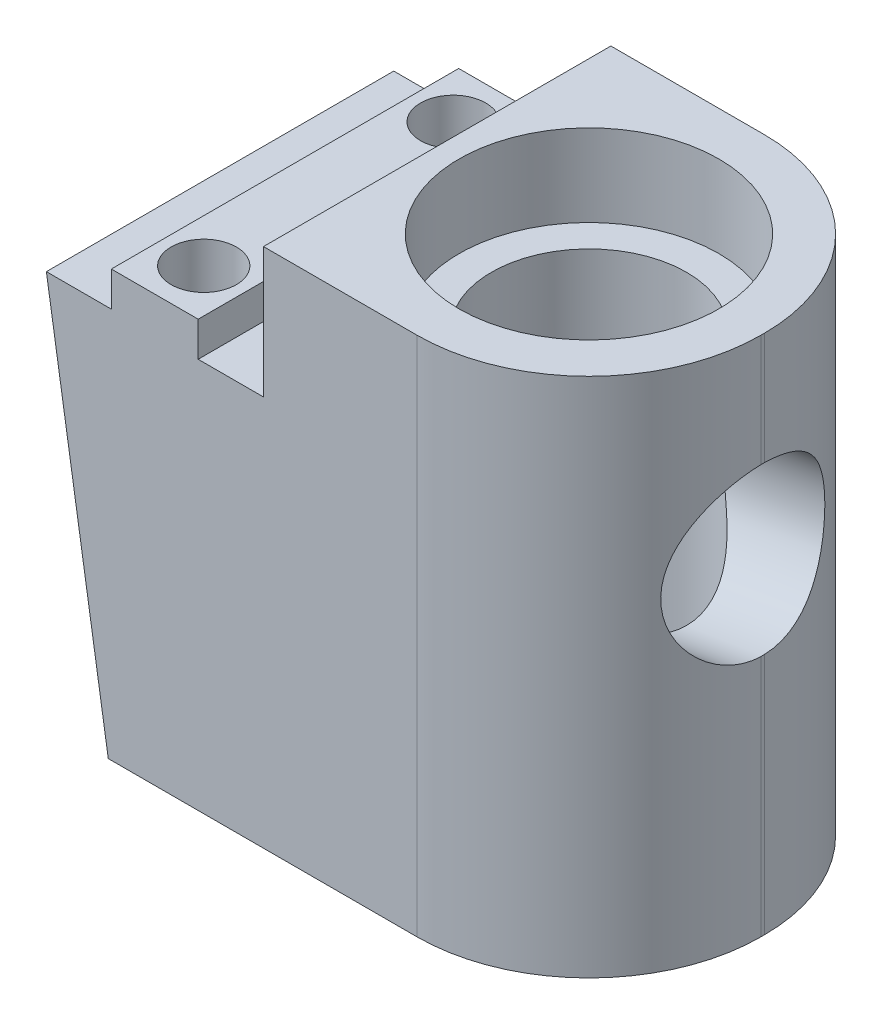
SolidWorks part; units mm, degrees
ref_plane "Front Plane" through (0, 0, 0) normal (0, 0, 1) x (1, 0, 0)
ref_plane "Top Plane" through (0, 0, 0) normal (0, 1, 0) x (1, 0, 0)
ref_plane "Right Plane" through (0, 0, 0) normal (1, 0, 0) x (0, 0, -1)
sketch "Sketch1" plane through (0, 0, 0) normal (0, 0, 1) x (1, 0, 0)
  line L0 (0, 0) -> (-79.9391, 0) construction
  line L1 (-4.7498, 9.525) -> (-9.4996, 9.525)
  line L2 (6.3754, 19.05) -> (30.1752, 19.05)
  line L3 (30.1752, 19.05) -> (30.1752, -19.05)
  line L4 (30.1752, -19.05) -> (0, -19.05)
  line L5 (0, -19.05) -> (0, 0) construction
  line L6 (0, 0) -> (-52.9129, -8.3806) construction
  line L7 (0, 0) -> (30.1752, 4.7793)
  line L9 (-4.9738, -19.05) -> (-9.4996, 9.525)
  line L10 (10.3378, 13.0556) -> (10.3378, -13.0556)
  line L13 (17.4752, 19.05) -> (17.4752, -19.05) construction
  line L14 (7.9756, 19.05) -> (7.9756, 13.0556)
  line L15 (7.9756, 13.0556) -> (26.9748, 13.0556)
  line L16 (26.9748, 13.0556) -> (26.9748, 19.05)
  line L17 (7.9756, -19.05) -> (7.9756, -13.0556)
  line L18 (7.9756, -13.0556) -> (26.9748, -13.0556)
  line L19 (26.9748, -13.0556) -> (26.9748, -19.05)
  line L20 (6.3754, 19.05) -> (6.3754, 9.525)
  line L21 (6.3754, 9.525) -> (1.6002, 9.525)
  line L24 (1.6002, 12.065) -> (-4.7498, 12.065)
  line L25 (-4.7498, 12.065) -> (-4.7498, 9.525)
  line L26 (24.6126, 13.0556) -> (24.6126, -13.0556)
  line L27 (1.6002, 12.065) -> (1.6002, 9.525)
  line L28 (0, -19.05) -> (-4.9738, -19.05)
  point P23 (-7.991, 0)
  dimension "D2" = 30.1752
  dimension "D3" = 19.05
  dimension "D4" = 19.05
  dimension "D5" = 9
  dimension "D7" = 18.9992
  dimension "D8" = 12.7
  dimension "D9" = 5.9944
  dimension "D10" = 23.7998
  dimension "D11" = 3.2004
  dimension "D12" = 9.525
  dimension "D13" = 4.7752
  dimension "D14" = 6.35
  dimension "D15" = 2.54
  dimension "D16" = 15.875
  dimension "D17" = 14.2748
  dimension "D18" = 1.6002
  dimension "D19" = 18.3288
sketch "Sketch2" plane through (0, 0, 0) normal (0, 0, 1) x (1, 0, 0)
  line L0 (0, -19.05) -> (-4.9738, -19.05) construction
  line L1 (30.1752, 19.05) -> (30.1752, -19.05) construction
  line L2 (0, -19.05) -> (-4.9738, -19.05)
  line L5 (-4.9738, -19.05) -> (-9.4996, 9.525) construction
  line L8 (6.3754, 19.05) -> (30.1752, 19.05) construction
  line L9 (30.1752, 19.05) -> (30.1752, -19.05)
  line L12 (6.3754, 19.05) -> (6.3754, 9.525) construction
  line L13 (-4.9738, -19.05) -> (-9.4996, 9.525)
  line L15 (6.3754, 19.05) -> (30.1752, 19.05)
  line L18 (30.1752, -19.05) -> (0, -19.05) construction
  line L19 (30.1752, -19.05) -> (0, -19.05)
  line L21 (6.3754, 19.05) -> (6.3754, 9.525)
  line L22 (6.3754, 9.525) -> (1.6002, 9.525) construction
  line L23 (1.6002, 12.065) -> (1.6002, 9.525) construction
  line L24 (-4.7498, 12.065) -> (-4.7498, 9.525) construction
  line L25 (1.6002, 12.065) -> (-4.7498, 12.065) construction
  line L27 (-4.7498, 12.065) -> (-4.7498, 9.525)
  line L28 (1.6002, 12.065) -> (-4.7498, 12.065)
  line L29 (6.3754, 9.525) -> (1.6002, 9.525)
  line L30 (-4.7498, 9.525) -> (-9.4996, 9.525)
  line L31 (1.6002, 12.065) -> (1.6002, 9.525)
extrude "Boss-Extrude1" add sketch "Sketch2" along normal mid plane 25.4
sketch "Sketch3" plane through (0, 19.05, 0) normal (0, 1, 0) x (1, 0, 0)
  circle A0 centre (17.4752, 0) radius 9.4996
extrude "Cut-Extrude1" cut sketch "Sketch3" against normal up to vertex (5.9944 mm away)
sketch "Sketch4" plane through (0, -19.05, 0) normal (0, -1, 0) x (1, 0, 0)
  circle A0 centre (17.4752, 0) radius 9.4996
extrude "Cut-Extrude2" cut sketch "Sketch4" against normal up to vertex (5.9944 mm away)
sketch "Sketch5" plane through (0, 13.0556, 0) normal (0, 1, 0) x (1, 0, 0)
  line L0 (7.9756, 0) -> (26.9748, 0) construction
  circle A0 centre (17.4752, 0) radius 7.1374
extrude "Cut-Extrude3" cut sketch "Sketch5" against normal blind 33.655
fillet "Fillet1" radius 12.573 2 edges at (30.1752, 0, -12.7) (30.1752, 0, 12.7)
sketch "Sketch6" plane through (-7.7954, -1.2347, 0) normal (-0.9877, -0.1564, 0) x (0, 0, 1)
  circle A0 centre (0, 0) radius 6
  dimension "D1" = 12
extrude "Cut-Extrude4" cut sketch "Sketch6" against normal blind 51.435
sketch "Sketch8" plane through (0, 12.065, 0) normal (0, 1, 0) x (1, 0, 0)
  line L0 (1.6002, 0) -> (-4.7498, 0) construction
  line L2 (-4.7498, -12.7) -> (-4.7498, 12.7) construction
  line L3 (-1.5748, 0) -> (-1.5748, 2.9098) construction
  line L4 (1.6002, -12.7) -> (1.6002, 12.7) construction
  circle A0 centre (-1.5748, 9.1186) radius 2.3876
  circle A1 centre (-1.5748, -9.1186) radius 2.3876
  dimension "D1" = 4.7752
  dimension "D2" = 18.2372
extrude "Cut-Extrude6" cut sketch "Sketch8" against normal blind 15.24
sketch "Sketch9" plane through (-7.7954, -1.2347, 0) normal (-0.9877, -0.1564, 0) x (0, 0, 1)
  line L0 (0, 0) -> (0, 5.4725) construction
  circle A0 centre (-8.7376, -13.4874) radius 2.3876
  circle A1 centre (8.7376, -13.4874) radius 2.3876
  dimension "D2" = 4.7752
  dimension "D1" = 13.4874
  dimension "D3" = 17.4752
extrude "Cut-Extrude7" cut sketch "Sketch9" against normal blind 14.2748
